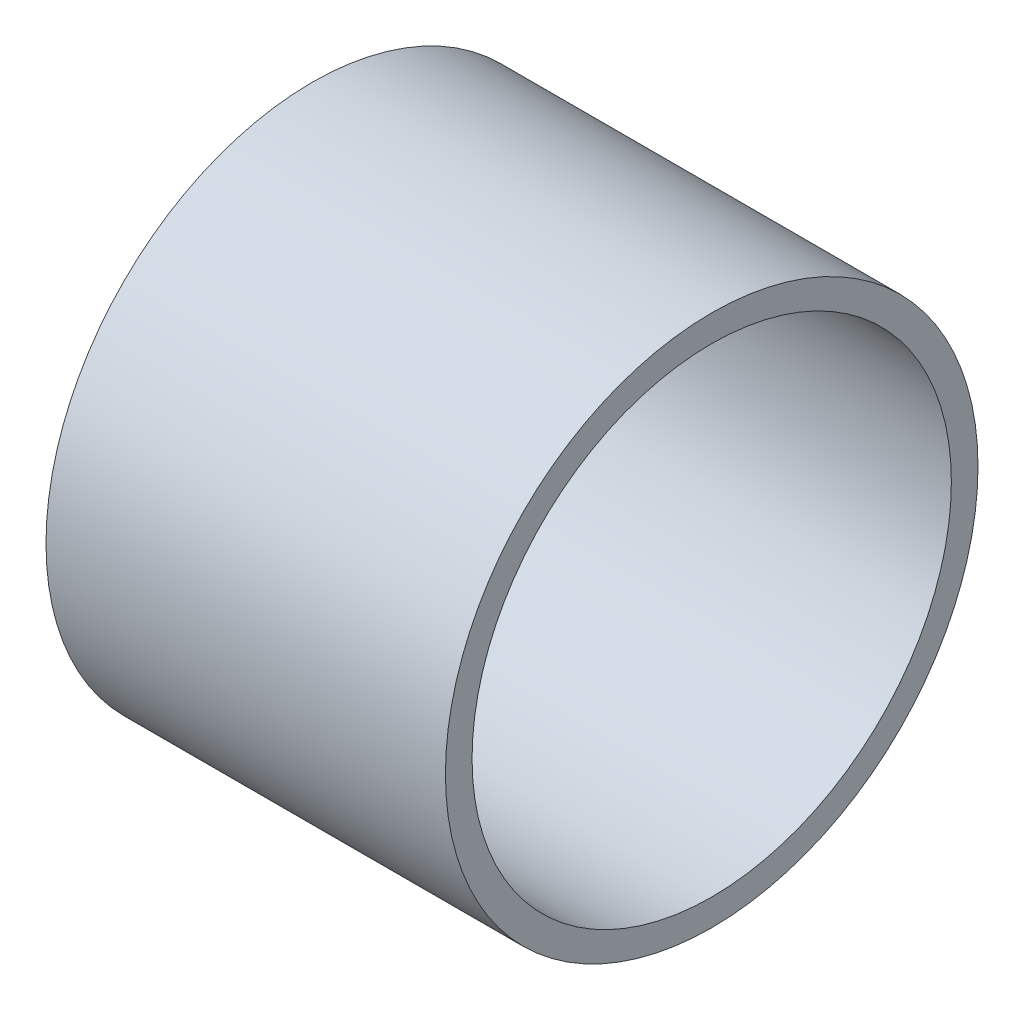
SolidWorks part; units mm, degrees
ref_plane "Plan de face" through (0, 0, 0) normal (0, 0, 1) x (1, 0, 0)
ref_plane "Plan de dessus" through (0, 0, 0) normal (0, 1, 0) x (1, 0, 0)
ref_plane "Plan de droite" through (0, 0, 0) normal (1, 0, 0) x (0, 0, -1)
ref_plane "Plan4" through (0, 0, 0) normal (0, 0, -1) x (-1, 0, 0)
sketch "Esquisse1" plane through (0, 0, 0) normal (0, 0, -1) x (-1, 0, 0)
  line L0 (-60, 40) -> (-60, 36)
  line L1 (-60, 36) -> (0, 36)
  line L2 (0, 36) -> (0, 40)
  line L3 (0, 40) -> (-60, 40)
  line L4 (-60, 0) -> (0, 0) construction
revolve "Révolution1" add sketch "Esquisse1" angle 360 about L4
